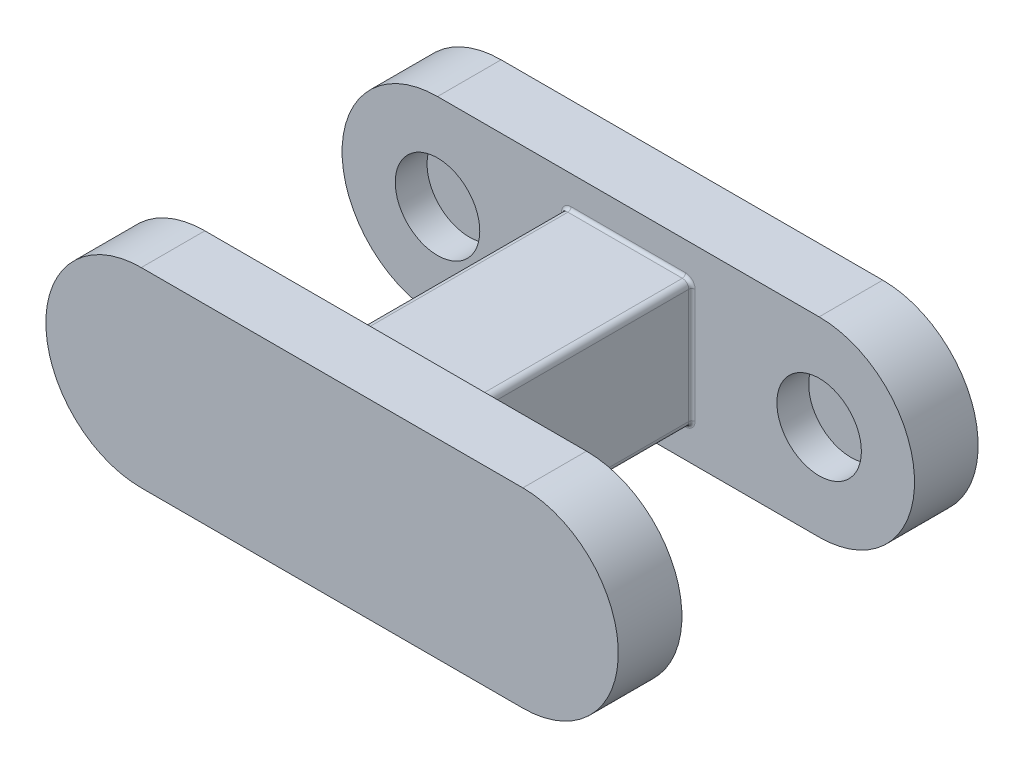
SolidWorks part; units mm, degrees
ref_plane "Front Plane" through (0, 0, 0) normal (0, 0, 1) x (1, 0, 0)
ref_plane "Top Plane" through (0, 0, 0) normal (0, 1, 0) x (1, 0, 0)
ref_plane "Right Plane" through (0, 0, 0) normal (1, 0, 0) x (0, 0, -1)
sketch "Sketch1" plane through (0, 0, 0) normal (0, 0, 1) x (1, 0, 0)
  line L0 (-76.2, 0) -> (76.2, 0) construction
  line L1 (-76.2, 38.1) -> (76.2, 38.1)
  line L2 (-76.2, -38.1) -> (76.2, -38.1)
  arc A0 (-76.2, 38.1) -> (-76.2, -38.1) centre (-76.2, 0) ccw
  arc A1 (76.2, -38.1) -> (76.2, 38.1) centre (76.2, 0) ccw
  point P2 (0, 0)
  point P7 (76.2, 0)
  point P8 (-76.2, 0)
  dimension "D1" = 38.1
extrude "Boss-Extrude1" add sketch "Sketch1" along normal blind 25.4
sketch "Sketch4" plane through (0, 0, 25.4) normal (0, 0, 1) x (1, 0, 0)
  circle A0 centre (76.2, 0) radius 16.875
  circle A1 centre (-76.2, 0) radius 16.875
extrude "Cut-Extrude1" cut sketch "Sketch4" against normal blind 12.7
sketch "Sketch5" plane through (0, 0, 25.4) normal (0, 0, 1) x (1, 0, 0)
  line L0 (-76.2, -38.1) -> (76.2, -38.1) construction
  line L1 (-25.4, 25.4) -> (25.4, 25.4)
  line L2 (-25.4, 25.4) -> (-25.4, -25.4)
  line L3 (-25.4, -25.4) -> (25.4, -25.4)
  line L4 (25.4, 25.4) -> (25.4, -25.4)
  line L5 (-25.4, 25.4) -> (25.4, -25.4) construction
  line L6 (-25.4, -25.4) -> (25.4, 25.4) construction
  circle A0 centre (-76.2, 0) radius 16.875 construction
  point P0 (0, 0)
  dimension "D1" = 12.7
  dimension "D2" = 50.8
extrude "Boss-Extrude2" add sketch "Sketch5" along normal blind 92.9
ref_plane "Plane4" through (0, 0, 71.85) normal (0, 0, 1) x (1, 0, 0)
mirror "Mirror2" about plane through (0, 0, 71.85) normal (0, 0, 1) of "Cut-Extrude1", "Boss-Extrude1"
fillet "Fillet1" radius 2.54 4 edges at (25.4, 25.4, 71.85) (25.4, -25.4, 71.85) (-25.4, -25.4, 71.85) (-25.4, 25.4, 71.85)
fillet "Fillet2" radius 1.27 8 edges at (-24.6561, 24.6561, 25.4) (0, 25.4, 25.4) (24.6561, 24.6561, 25.4) (25.4, 0, 25.4) (24.6561, -24.6561, 25.4) (0, -25.4, 25.4) (-24.6561, -24.6561, 25.4) (-25.4, 0, 25.4)
fillet "Fillet3" radius 1.27 8 edges at (-24.6561, 24.6561, 118.3) (0, 25.4, 118.3) (24.6561, 24.6561, 118.3) (25.4, 0, 118.3) (24.6561, -24.6561, 118.3) (0, -25.4, 118.3) (-24.6561, -24.6561, 118.3) (-25.4, 0, 118.3)
equation "\"D2@Sketch4\"=\"D1@Sketch4\""
